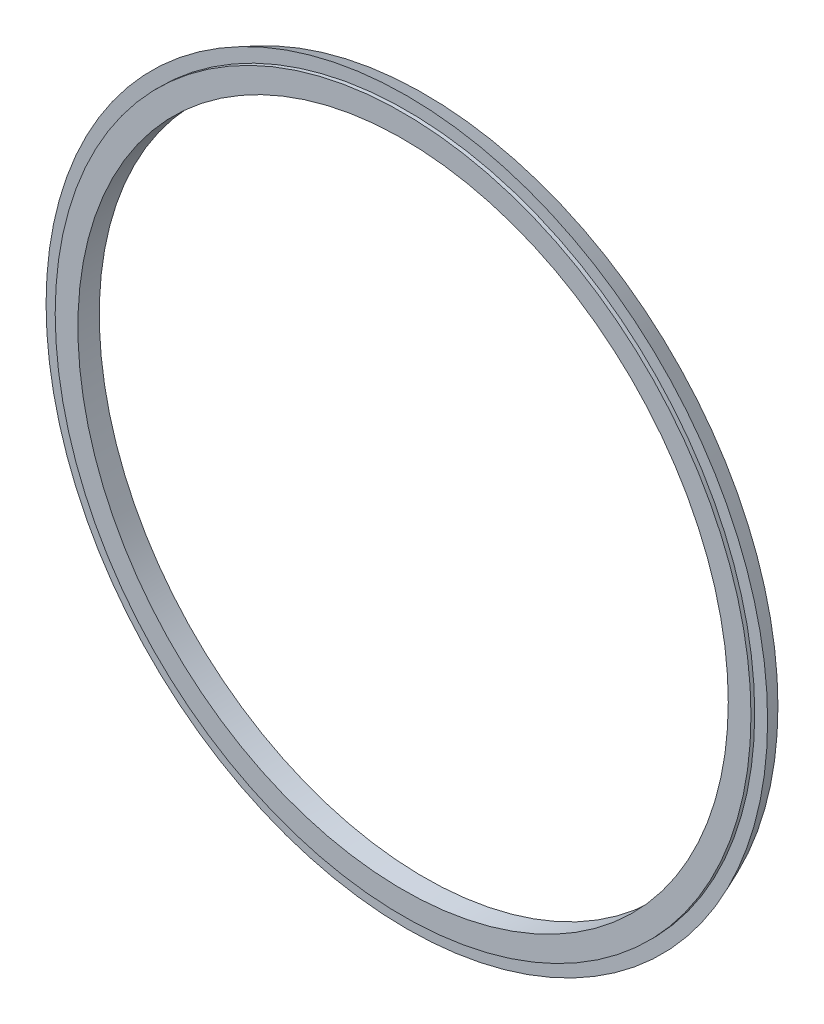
SolidWorks part; units mm, degrees
ref_plane "Front" through (0, 0, 0) normal (0, 0, 1) x (1, 0, 0)
ref_plane "Top" through (0, 0, 0) normal (0, 1, 0) x (1, 0, 0)
ref_plane "Right" through (0, 0, 0) normal (1, 0, 0) x (0, 0, -1)
sketch "Sketch2" plane through (0, 0, 0) normal (1, 0, 0) x (0, 0, -1)
  line L0 (35.6834, 95.1276) -> (42.0334, 92.4973) construction
  line L1 (34.0959, 97.5034) -> (38.8584, 95.5307)
  line L2 (33.0799, 94.0211) -> (33.0799, 87.8897)
  line L3 (33.0799, 87.8897) -> (38.8584, 87.8897)
  line L4 (38.8584, 95.5307) -> (38.8584, 93.3491)
  line L5 (38.8584, 89.9217) -> (38.8584, 87.8897)
  line L6 (34.0959, 94.0211) -> (33.0799, 94.0211)
  line L7 (34.0959, 94.0211) -> (34.0959, 97.5034)
  line L8 (-5.08, 0) -> (103.0735, 0)
  line L10 (38.8584, 87.8389) -> (36.4771, 87.8389) construction
  line L11 (38.8584, 93.3491) -> (36.6127, 93.9509)
  line L12 (38.8584, 93.8124) -> (38.8584, -120.6078) construction
  line L13 (38.8584, 89.9217) -> (36.547, 89.9217)
  line L14 (36.293, 93.7055) -> (36.293, 90.1757)
  arc A0 (36.6127, 93.9509) -> (36.293, 93.7055) centre (36.547, 93.7055) ccw
  arc A1 (36.547, 89.9217) -> (36.293, 90.1757) centre (36.547, 90.1757) cw
  point P14 (36.293, 94.0365)
  point P20 (36.293, 89.9217)
  dimension "D15" = 0.254
  dimension "D1" = 5.7785
  dimension "D2" = 6.1314
  dimension "D3" = 4.1148
  dimension "D4" = 2.5654
  dimension "D5" = 2.032
  dimension "D6" = 87.8897
  dimension "D7" = 1.5875
  dimension "D8" = 22.5
  dimension "D9" = 75
  dimension "D10" = 2.1971
  dimension "D11" = 3.2131
  dimension "D12" = 1.016
  dimension "D13" = 0.0508
  dimension "D14" = 2.3622
revolve "Revolve2" add sketch "Sketch2" angle 360 about L8
